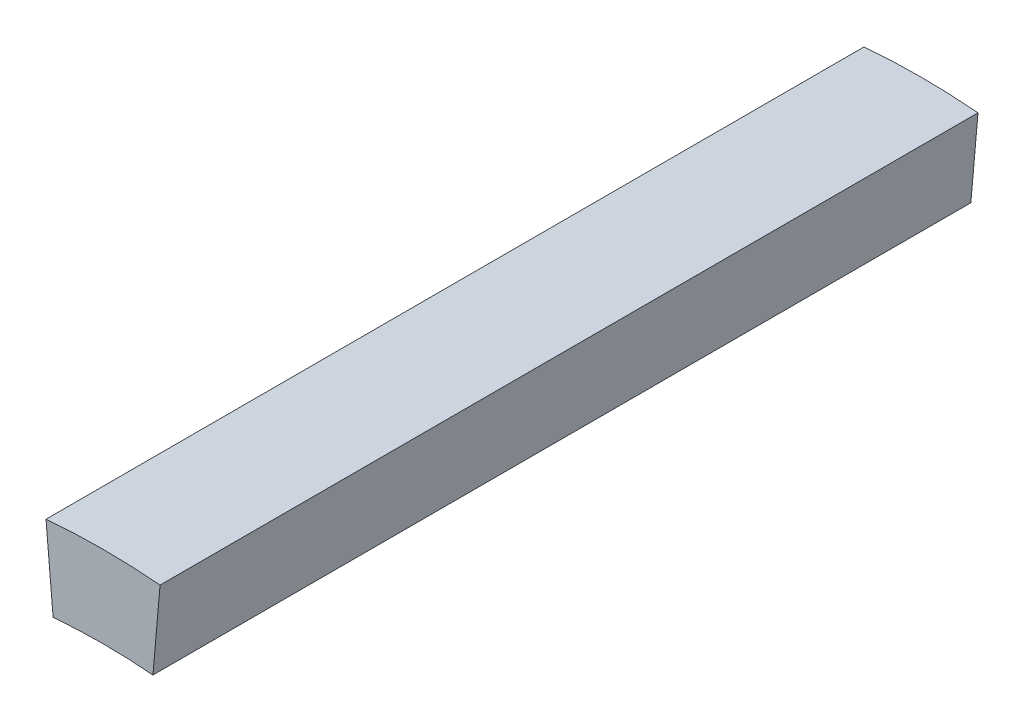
SolidWorks part; units mm, degrees
ref_plane "Face" through (0, 0, 0) normal (0, 0, 1) x (1, 0, 0)
ref_plane "Dessus" through (0, 0, 0) normal (0, 1, 0) x (1, 0, 0)
ref_plane "Droite" through (0, 0, 0) normal (1, 0, 0) x (0, 0, -1)
sketch "Esquisse1" plane through (0, 0, 0) normal (0, 0, 1) x (1, 0, 0)
  line L0 (0, 0) -> (0, 78.7504) construction
  line L1 (-0.6101, 6.9734) -> (-0.6972, 7.9696)
  line L2 (0.6972, 7.9696) -> (0.6101, 6.9734)
  arc A0 (-0.6101, 6.9734) -> (0.6101, 6.9734) centre (0, 0) cw
  arc A1 (-0.6972, 7.9696) -> (0.6972, 7.9696) centre (0, 0) cw
  dimension "D1" = 7
  dimension "D2" = 8
  dimension "D3" = 10
extrude "Boss.-Extru.1" add sketch "Esquisse1" along normal blind 10
